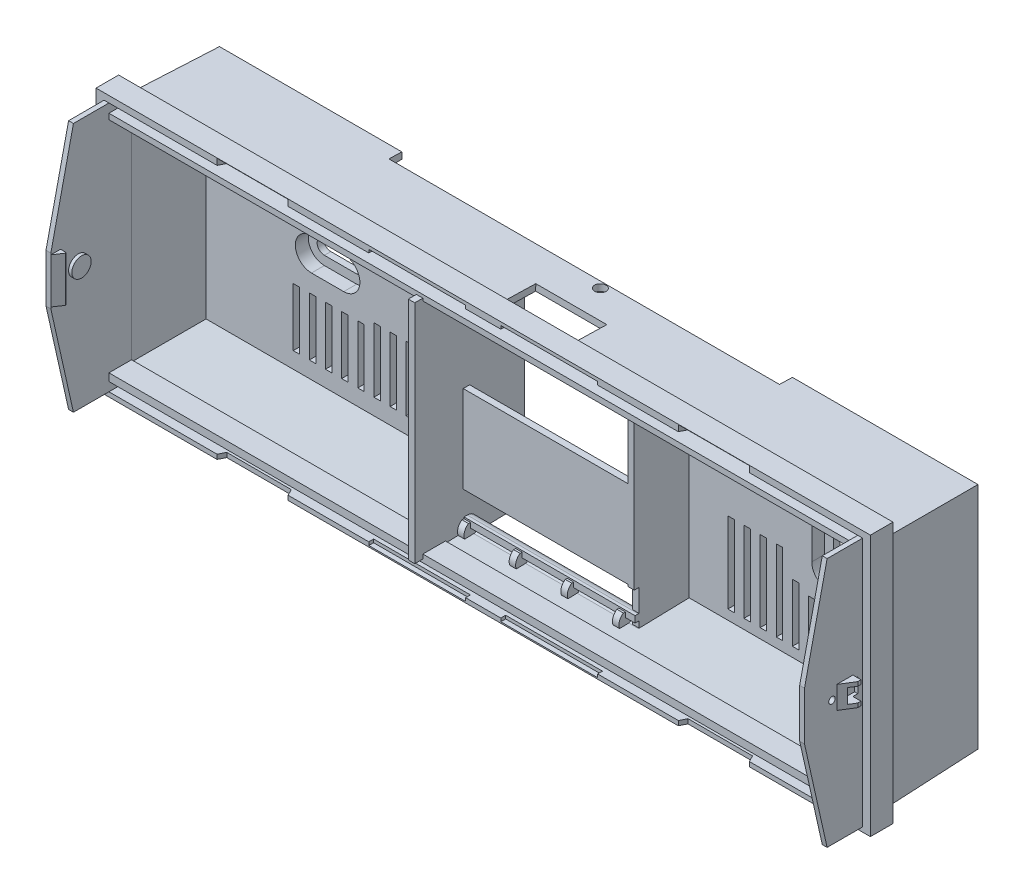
SolidWorks part; units mm, degrees
ref_plane "Plan1" through (0, 0, 0) normal (0, 0, 1) x (1, 0, 0)
ref_plane "Plan2" through (0, 0, 0) normal (0, 1, 0) x (1, 0, 0)
ref_plane "Plan3" through (0, 0, 0) normal (1, 0, 0) x (0, 0, -1)
sketch "Esquisse1" plane through (0, 0, 0) normal (0, 0, 1) x (1, 0, 0)
  line L1 (-124, 35.5) -> (111, 35.5)
  line L2 (-124, 35.5) -> (-124, -35.5)
  line L3 (-124, -35.5) -> (111, -35.5)
  line L4 (111, 35.5) -> (111, -35.5)
  dimension "D1" = 235
  dimension "D2" = 71
  dimension "D3" = 35.5
  dimension "D4" = 111
extrude "Extrusion1" add sketch "Esquisse1" along normal blind 1.5
sketch "Esquisse2" plane through (0, 0, 0) normal (0, 0, -1) x (-1, 0, 0)
  line L1 (-111, 35.5) -> (124, 35.5)
  line L2 (-111, 35.5) -> (-111, -35.5)
  line L3 (-111, -35.5) -> (124, -35.5)
  line L4 (124, 35.5) -> (124, -35.5)
extrude "Extrusion2" add sketch "Esquisse2" against normal blind 28.5 draft 1.5 from offset 4 contours L2 L3 L4 L1
sketch "Esquisse3" plane through (0, 0, 24.5) normal (0, 0, 1) x (1, 0, 0)
  line L0 (111.7463, 36.2463) -> (-124.7463, 36.2463) construction
  line L1 (-122.7463, 34.2463) -> (109.7463, 34.2463)
  line L2 (-122.7463, 34.2463) -> (-122.7463, -34.2463)
  line L3 (-122.7463, -34.2463) -> (109.7463, -34.2463)
  line L4 (109.7463, 34.2463) -> (109.7463, -34.2463)
  line L5 (-124.7463, 36.2463) -> (-124.7463, -36.2463) construction
  line L6 (111.7463, -36.2463) -> (-124.7463, -36.2463) construction
  line L7 (111.7463, 36.2463) -> (111.7463, -36.2463) construction
  dimension "D1" = 2
  dimension "D2" = 2
  dimension "D3" = 2
  dimension "D4" = 2
extrude "Enlèv. mat.-Extru.1" cut sketch "Esquisse3" against normal blind 22.5 draft 1.5
sketch "Esquisse4" plane through (0, 0, -4) normal (0, 0, -1) x (-1, 0, 0)
  line L0 (-111, 35.5) -> (124, 35.5) construction
  line L1 (-109, 33.5) -> (122, 33.5)
  line L2 (-109, 33.5) -> (-109, -33.5)
  line L3 (-109, -33.5) -> (122, -33.5)
  line L4 (122, 33.5) -> (122, -33.5)
  line L5 (-111, 35.5) -> (-111, -35.5) construction
  line L6 (-111, -35.5) -> (124, -35.5) construction
  line L7 (124, 35.5) -> (124, -35.5) construction
  dimension "D1" = 2
  dimension "D2" = 2
  dimension "D3" = 2
  dimension "D4" = 2
extrude "Enlèv. mat.-Extru.2" cut sketch "Esquisse4" against normal blind 4
sketch "Esquisse5" plane through (0, 0, 0) normal (0, 1, 0) x (1, 0, 0)
  line L1 (111, 4) -> (-124, 4) construction
  line L2 (-67.5, 4) -> (53.5, 4)
  line L3 (-67.5, 4) -> (-67.5, 0)
  line L4 (-67.5, 0) -> (53.5, 0)
  line L5 (53.5, 4) -> (53.5, 0)
  dimension "D1" = 4
  dimension "D2" = 121
  dimension "D3" = 67.5
extrude "Enlèv. mat.-Extru.3" cut sketch "Esquisse5" against normal mid plane 80
sketch "Esquisse6" plane through (0, 0, 0) normal (0, 0, -1) x (-1, 0, 0)
  line L0 (-111.7463, -36.2463) -> (124.7463, -36.2463) construction
  line L1 (-25.5, 33.6047) -> (25.5, 33.6047)
  line L2 (-25.5, 33.6047) -> (-25.5, -36.2463)
  line L3 (-25.5, -36.2463) -> (25.5, -36.2463)
  line L4 (25.5, 33.6047) -> (25.5, -36.2463)
  line L5 (-53.5, 35.6047) -> (67.5, 35.6047) construction
  dimension "D1" = 51
  dimension "D2" = 25.5
  dimension "D3" = 2
extrude "Enlèv. mat.-Extru.4" cut sketch "Esquisse6" against normal blind 17
sketch "Esquisse7" plane through (0, 35.5803, -0.9317) normal (0, 0.9997, -0.0262) x (-1, 0, 0)
  line L0 (-53.5, 0.932) -> (67.5, 0.932) construction
  line L2 (-11, 11.932) -> (11, 11.932)
  line L3 (-11, 11.932) -> (-11, 22.432)
  line L4 (-11, 22.432) -> (11, 22.432)
  line L5 (11, 11.932) -> (11, 22.432)
  circle A0 centre (0, 2.932) radius 1.75
  dimension "D1" = 3.5
  dimension "D2" = 2
  dimension "D3" = 10.5
  dimension "D4" = 22
  dimension "D5" = 11
  dimension "D6" = 11
extrude "Enlèv. mat.-Extru.5" cut sketch "Esquisse7" against normal blind 10
sketch "Esquisse8" plane through (0, 0, 0) normal (0, 0, -1) x (-1, 0, 0)
  line L0 (-25.5, 33.6047) -> (-25.5, -35.6047) construction
  line L1 (-111, 35.5) -> (-53.5, 35.5) construction
  line L2 (-78.5, 5) -> (-78.5, -5)
  line L3 (67.5, 35.5) -> (124, 35.5) construction
  line L4 (-62.5, 5) -> (-62.5, -5)
  line L5 (79.5, 8) -> (89.5, 8)
  line L6 (25.5, -35.6047) -> (25.5, 33.6047) construction
  line L7 (79.5, -8) -> (89.5, -8)
  arc A0 (-78.5, 5) -> (-62.5, 5) centre (-70.5, 5) cw
  arc A1 (-62.5, -5) -> (-78.5, -5) centre (-70.5, -5) cw
  arc A2 (79.5, 8) -> (79.5, -8) centre (79.5, 0) ccw
  arc A3 (89.5, 8) -> (89.5, -8) centre (89.5, 0) cw
  dimension "D7" = 8
  dimension "D8" = 8
  dimension "D1" = 16
  dimension "D2" = 10
  dimension "D3" = 10
  dimension "D4" = 10
  dimension "D5" = 53
  dimension "D6" = 30.5
  dimension "D9" = 10
  dimension "D10" = 10
  dimension "D11" = 10
  dimension "D12" = 16
  dimension "D13" = 35.5
  dimension "D14" = 64
extrude "Extrusion3" add sketch "Esquisse8" along normal blind 4
sketch "Esquisse9" plane through (81.6987, 0.3521, -4) normal (0, 0, -1) x (-1, 0, 0)
  line L2 (161.1987, 4.6479) -> (171.1987, 4.6479)
  line L4 (161.1987, -5.3521) -> (171.1987, -5.3521)
  line L8 (6.1987, 4.6479) -> (6.1987, -5.3521)
  line L9 (16.1987, 4.6479) -> (16.1987, -5.3521)
  arc A0 (19.1987, 4.6479) -> (3.1987, 4.6479) centre (11.1987, 4.6479) ccw construction
  arc A1 (3.1987, -5.3521) -> (19.1987, -5.3521) centre (11.1987, -5.3521) ccw construction
  arc A2 (171.1987, -8.3521) -> (171.1987, 7.6479) centre (171.1987, -0.3521) ccw construction
  arc A3 (161.1987, 7.6479) -> (161.1987, -8.3521) centre (161.1987, -0.3521) ccw construction
  arc A6 (16.1987, -5.3521) -> (6.1987, -5.3521) centre (11.1987, -5.3521) cw
  arc A7 (6.1987, 4.6479) -> (16.1987, 4.6479) centre (11.1987, 4.6479) cw
  arc A8 (171.1987, 4.6479) -> (171.1987, -5.3521) centre (171.1987, -0.3521) cw
  arc A9 (161.1987, 4.6479) -> (161.1987, -5.3521) centre (161.1987, -0.3521) ccw
  dimension "D7" = 10
  dimension "D8" = 5
  dimension "D2" = 5
  dimension "D5" = 5
  dimension "D1" = 5
  dimension "D3" = 10
  dimension "D4" = 10
  dimension "D6" = 10
  dimension "D9" = 10
  dimension "D10" = 10
extrude "Enlèv. mat.-Extru.6" cut sketch "Esquisse9" against normal blind 10 from offset 2
sketch "Esquisse10" plane through (0, 0, -4) normal (0, 0, -1) x (-1, 0, 0)
  line L2 (-72.75, 5) -> (-72.75, -5)
  line L3 (79.5, 2.25) -> (89.5, 2.25)
  line L4 (-68.25, 5) -> (-68.25, -5)
  line L6 (79.5, -2.25) -> (89.5, -2.25)
  arc A0 (-72.75, 5) -> (-68.25, 5) centre (-70.5, 5) cw
  arc A1 (-68.25, -5) -> (-72.75, -5) centre (-70.5, -5) cw
  arc A2 (-62.5, 5) -> (-78.5, 5) centre (-70.5, 5) ccw construction
  arc A3 (-78.5, -5) -> (-62.5, -5) centre (-70.5, -5) ccw construction
  arc A4 (79.5, 2.25) -> (79.5, -2.25) centre (79.5, 0) ccw
  arc A5 (89.5, 2.25) -> (89.5, -2.25) centre (89.5, 0) cw
  arc A6 (89.5, -8) -> (89.5, 8) centre (89.5, 0) ccw construction
  arc A7 (79.5, 8) -> (79.5, -8) centre (79.5, 0) ccw construction
  dimension "D2" = 2.25
  dimension "D3" = 4.5
  dimension "D5" = 10
  dimension "D1" = 4.5
  dimension "D4" = 10
  dimension "D6" = 10
extrude "Enlèv. mat.-Extru.7" cut sketch "Esquisse10" against normal blind 10
sketch "Esquisse11" plane through (0, 0, 2) normal (0, 0, 1) x (1, 0, 0)
  line L1 (25.5, 35) -> (27.5, 35)
  line L2 (25.5, 35) -> (25.5, -35)
  line L3 (25.5, -35) -> (27.5, -35)
  line L4 (27.5, 35) -> (27.5, -35)
  dimension "D1" = 2
  dimension "D2" = 70
  dimension "D3" = 35
  dimension "D4" = 25.5
extrude "Extrusion4" add sketch "Esquisse11" along normal blind 17
sketch "Esquisse12" plane through (0, 0, 2) normal (0, 0, 1) x (1, 0, 0)
  line L1 (-25.5, 35) -> (-27.5, 35)
  line L2 (-25.5, 35) -> (-25.5, -35)
  line L3 (-25.5, -35) -> (-27.5, -35)
  line L4 (-27.5, 35) -> (-27.5, -35)
  dimension "D1" = 2
  dimension "D2" = 70
  dimension "D3" = 35
  dimension "D4" = 25.5
extrude "Extrusion5" add sketch "Esquisse12" along normal blind 32
sketch "Esquisse13" plane through (25.5, 0, 0) normal (-1, 0, 0) x (0, 0, 1)
  line L1 (19, 4.5) -> (17, 4.5)
  line L2 (19, 4.5) -> (19, -22.5)
  line L3 (19, -22.5) -> (17, -22.5)
  line L4 (17, 4.5) -> (17, -22.5)
  line L6 (0, 0) -> (23.4559, 0) construction
  line L7 (19, 34.1023) -> (19, -34.1023) construction
  dimension "D1" = 2
  dimension "D2" = 27
  dimension "D3" = 4.5
extrude "Extrusion6" add sketch "Esquisse13" along normal up to next
sketch "Esquisse15" plane through (27.5, 0, 0) normal (1, 0, 0) x (0, 0, -1)
  line L0 (-19, -34.1023) -> (-19, 34.1023) construction
  line L1 (-17.5, -34.063) -> (-19, -34.1023)
  line L2 (-19, -34.1023) -> (-19, -23.1023)
  line L3 (-19, -23.1023) -> (-17.5, -23.1023)
  line L4 (-17.5, -34.063) -> (-17.5, -23.1023)
  line L7 (-19, -34.1023) -> (-2, -33.6571) construction
  point P11 (-13.9712, -36.3603)
  dimension "D1" = 11
  dimension "D2" = 1.5
extrude "Enlèv. mat.-Extru.8" cut sketch "Esquisse15" against normal blind 10
sketch "Esquisse14" plane through (-25.5, 0, 0) normal (1, 0, 0) x (0, 0, -1)
  line L0 (-24.5, -36.2463) -> (4, -35.5) construction
  line L1 (0, -35.6047) -> (0, 33.6047) construction
  line L2 (-17.75, -34.0695) -> (-17.75, -36.0695)
  line L3 (-17.75, -32.0695) -> (-18.75, -32.0695)
  line L4 (-18.75, -32.0695) -> (-18.75, -30.0695)
  line L5 (-18.75, -30.0695) -> (-17.75, -30.0695)
  arc A0 (-17.75, -36.0695) -> (-17.75, -30.0695) centre (-17.75, -33.0695) ccw
  arc A1 (-17.75, -34.0695) -> (-17.75, -32.0695) centre (-17.75, -33.0695) ccw
  dimension "D1" = 3
  dimension "D2" = 17.75
  dimension "D4" = 1
  dimension "D3" = 2
extrude "Extrusion7" add sketch "Esquisse14" along normal up to surface (53 mm away)
sketch "Esquisse16" plane through (-25.5, 0, 0) normal (1, 0, 0) x (0, 0, -1)
  line L0 (-20.3644, -34.5409) -> (-16.3644, -34.5409)
  line L1 (-16.3644, -34.5409) -> (-16.3644, -30.5409)
  line L2 (-16.3644, -30.5409) -> (-19.3644, -30.5409)
  arc A0 (-17.6977, -34.0682) -> (-17.75, -32.0695) centre (-17.75, -33.0695) ccw construction
  arc A2 (-19.3644, -30.5409) -> (-20.3644, -34.5409) centre (-17.75, -33.0695) ccw
  point P1 (-18.6119, -29.1773)
  point P7 (-19.9491, -35.2924)
  dimension "D1" = 3
  dimension "D2" = 4
  dimension "D3" = 4
  dimension "D4" = 1
extrude "Extrusion8" add sketch "Esquisse16" along normal blind 2
pattern_linear "Répétition linéaire1" count 4 spacing 16 along (1, 0, 0) of "Extrusion8"
sketch "Esquisse17" plane through (0, 0, 24.5) normal (0, 0, 1) x (1, 0, 0)
  line L1 (-122.7463, 34.2463) -> (109.1571, 34.2463)
  line L2 (-122.7463, 34.2463) -> (-122.7463, -33.6571)
  line L3 (-122.7463, -33.6571) -> (109.1571, -33.6571)
  line L4 (109.1571, 34.2463) -> (109.1571, -33.6571)
  line L5 (-126.7463, 40.7463) -> (113.1571, 40.7463)
  line L6 (-126.7463, 40.7463) -> (-126.7463, -40.1571)
  line L7 (-126.7463, -40.1571) -> (113.1571, -40.1571)
  line L8 (113.1571, 40.7463) -> (113.1571, -40.1571)
  dimension "D1" = 6.5
  dimension "D2" = 6.5
  dimension "D3" = 4
  dimension "D4" = 4
extrude "Extrusion9" add sketch "Esquisse17" along normal blind 7
sketch "Esquisse18" plane through (0, 0, 31.5) normal (0, 0, 1) x (1, 0, 0)
  line L0 (-122.7463, 34.2463) -> (-122.7463, -33.6571) construction
  line L1 (-122.7463, 35.9963) -> (109.1571, 35.9963)
  line L2 (-122.7463, 35.9963) -> (-122.7463, 38.7463)
  line L3 (-122.7463, 38.7463) -> (109.1571, 38.7463)
  line L4 (109.1571, 35.9963) -> (109.1571, 38.7463)
  line L5 (109.1571, -33.6571) -> (109.1571, 34.2463) construction
  line L6 (113.1571, 40.7463) -> (-126.7463, 40.7463) construction
  line L7 (0, 0) -> (-126.1043, 0) construction
  line L8 (109.1571, -35.9963) -> (109.1571, -38.7463)
  line L9 (-122.7463, -38.7463) -> (109.1571, -38.7463)
  line L10 (-122.7463, -35.9963) -> (-122.7463, -38.7463)
  line L11 (-122.7463, -35.9963) -> (109.1571, -35.9963)
  dimension "D1" = 2.75
  dimension "D2" = 2
extrude "Enlèv. mat.-Extru.9" cut sketch "Esquisse18" against normal blind 5
sketch "Esquisse19" plane through (0, -40.1571, 0) normal (0, -1, 0) x (1, 0, 0)
  line L0 (-126.7463, 31.5) -> (113.1571, 31.5) construction
  line L1 (-67.2463, 31.5) -> (-89.2463, 31.5)
  line L2 (-68.2463, 29.5) -> (-67.2463, 31.5)
  line L3 (-68.2463, 29.5) -> (-88.2463, 29.5)
  line L4 (-88.2463, 29.5) -> (-89.2463, 31.5)
  line L5 (113.1571, 31.5) -> (113.1571, 24.5) construction
  line L6 (74.6571, 29.5) -> (75.6571, 31.5)
  line L7 (54.6571, 29.5) -> (74.6571, 29.5)
  line L8 (54.6571, 29.5) -> (53.6571, 31.5)
  line L9 (53.6571, 31.5) -> (75.6571, 31.5)
  line L10 (-126.7463, 31.5) -> (-126.7463, 24.5) construction
  point P6 (113.1571, 28)
  point P13 (-126.7463, 28)
  dimension "D1" = 2
  dimension "D2" = 20
  dimension "D3" = 22
  dimension "D4" = 1
  dimension "D5" = 38.5
  dimension "D6" = 22
  dimension "D7" = 20
  dimension "D9" = 1
  dimension "D10" = 2
  dimension "D11" = 38.5
extrude "Enlèv. mat.-Extru.10" cut sketch "Esquisse19" against normal blind 2.5 and the other way blind 0.5
sketch "Esquisse20" plane through (0, 0, 31.5) normal (0, 0, 1) x (1, 0, 0)
  line L0 (-67.2463, -38.7463) -> (53.6571, -38.7463) construction
  line L1 (-42.2463, -38.7463) -> (-12.2463, -38.7463)
  line L2 (-42.2463, -38.7463) -> (-42.2463, -39.7463)
  line L3 (-42.2463, -39.7463) -> (-12.2463, -39.7463)
  line L4 (-12.2463, -38.7463) -> (-12.2463, -39.7463)
  line L5 (-67.2463, -38.7463) -> (-67.2463, -40.1571) construction
  line L6 (28.6571, -38.7463) -> (-1.3429, -38.7463)
  line L7 (28.6571, -38.7463) -> (28.6571, -39.7463)
  line L8 (28.6571, -39.7463) -> (-1.3429, -39.7463)
  line L9 (-1.3429, -38.7463) -> (-1.3429, -39.7463)
  point P10 (-67.2463, -39.4517)
  dimension "D1" = 1
  dimension "D2" = 30
  dimension "D3" = 25
  dimension "D4" = 1
  dimension "D5" = 30
  dimension "D6" = 25
extrude "Enlèv. mat.-Extru.11" cut sketch "Esquisse20" against normal blind 1.5
mirror "Symétrie1" about plane through (0, 0, 0) normal (0, 1, 0) of "Enlèv. mat.-Extru.10", "Enlèv. mat.-Extru.11"
sketch "Esquisse22" plane through (-122.7463, 0, 0) normal (1, 0, 0) x (0, 0, -1)
  line L0 (-31.5, -38.7463) -> (-42.5, -38.7463)
  line L1 (-42.5, -38.7463) -> (-49.5, -7.5013)
  line L2 (-49.5, -7.5013) -> (-49.5, 7.4987)
  line L3 (-49.5, 7.4987) -> (-42.5, 38.7463)
  line L4 (-42.5, 38.7463) -> (-31.5, 38.7463)
  line L6 (-31.5, 38.7463) -> (-31.5, -38.7463)
  line L10 (-26.5, -38.7463) -> (-31.5, -38.7463) construction
  line L11 (-26.5, 38.7463) -> (-31.5, 38.7463) construction
  dimension "D1" = 11
  dimension "D2" = 11
  dimension "D3" = 7
  dimension "D4" = 15
  dimension "D5" = 31.245
extrude "Extrusion11" add sketch "Esquisse22" against normal blind 1.5
sketch "Esquisse23" plane through (0, 0, 0) normal (0, 1, 0) x (1, 0, 0)
  line L0 (-122.7463, -49.5) -> (-120.7463, -46.5)
  line L1 (-120.7463, -46.5) -> (-122.7463, -46.5)
  line L2 (-122.7463, -42.5) -> (-122.7463, -49.5) construction
  line L3 (-122.7463, -46.5) -> (-122.7463, -49.5)
  dimension "D1" = 2
  dimension "D2" = 3
extrude "Extrusion12" add sketch "Esquisse23" along normal mid plane 14
sketch "Esquisse24" plane through (0, 0, 0) normal (0, 1, 0) x (1, 0, 0)
  line L0 (-124.2463, -39.5) -> (-126.7463, -35.5)
  line L1 (-124.2463, -42.5) -> (-124.2463, -31.5) construction
  line L2 (-126.7463, -35.5) -> (-126.7463, -34.5)
  line L3 (-126.7463, -34.5) -> (-124.2463, -34.5)
  line L4 (-124.2463, -34.5) -> (-124.2463, -39.5)
  line L5 (-126.7463, -31.5) -> (-89.2463, -31.5) construction
  dimension "D1" = 2.5
  dimension "D2" = 1
  dimension "D3" = 4
  dimension "D4" = 3
extrude "Extrusion13" add sketch "Esquisse24" along normal mid plane 7
fillet "Congé1" radius 0.2 1 edges at (-120.7463, 0, 46.5)
sketch "Esquisse25" plane through (0, 0, 0) normal (0, 1, 0) x (1, 0, 0)
  line L0 (-125.4963, -37.5) -> (-123.2463, -36.0938)
  line L1 (-126.7463, -35.5) -> (-124.2463, -39.5) construction
  line L2 (-123.2463, -36.0938) -> (-123.2463, -33)
  line L3 (-123.2463, -33) -> (-127.2463, -33)
  line L4 (-127.2463, -33) -> (-127.2463, -37.5)
  line L5 (-127.2463, -37.5) -> (-125.4963, -37.5)
  line L6 (-124.2463, -34.5) -> (-126.7463, -34.5) construction
  line L7 (-124.2463, -31.5) -> (-124.2463, -42.5) construction
  line L8 (-126.7463, -35.5) -> (-124.2463, -39.5) construction
  dimension "D1" = 1.5
  dimension "D2" = 1
  dimension "D3" = 90
  dimension "D4" = 4
extrude "Enlèv. mat.-Extru.12" cut sketch "Esquisse25" against normal mid plane 4.5
sketch "Esquisse26" plane through (-124.2463, 0, 0) normal (-1, 0, 0) x (0, 0, 1)
  line L0 (50, 0) -> (-50, 0) construction
  line L1 (49.5, 7.4987) -> (49.5, -7.5013) construction
  circle A0 centre (41, 0) radius 1
  point P6 (49.5, -0.0013)
  dimension "D1" = 2
  dimension "D2" = 8.5
extrude "Enlèv. mat.-Extru.13" cut sketch "Esquisse26" against normal blind 2
sketch "Esquisse27" plane through (-122.7463, 0, 0) normal (1, 0, 0) x (0, 0, -1)
  circle A0 centre (-41, 0) radius 3
  dimension "D1" = 6
extrude "Extrusion14" add sketch "Esquisse27" along normal blind 1
ref_plane "Plan4" through (-6.7463, 0, 0) normal (-1, 0, 0) x (0, 0, 1)
mirror "Symétrie3" about plane through (-6.7463, 0, 0) normal (-1, 0, 0) of "Extrusion14", "Enlèv. mat.-Extru.13", "Enlèv. mat.-Extru.12", "Congé1", "Extrusion13", "Extrusion12", "Extrusion11"
sketch "Esquisse28" plane through (0, 0, 2) normal (0, 0, 1) x (1, 0, 0)
  line L0 (-122.1571, 33.6571) -> (-122.1571, -33.6571) construction
  line L1 (-95.1571, 28.6571) -> (-93.1571, 28.6571)
  line L2 (-95.1571, 28.6571) -> (-95.1571, 8.6571)
  line L3 (-95.1571, 8.6571) -> (-93.1571, 8.6571)
  line L4 (-93.1571, 28.6571) -> (-93.1571, 8.6571)
  line L5 (-27.5, 33.6571) -> (-122.1571, 33.6571) construction
  line L6 (-90.1571, 28.6571) -> (-88.1571, 28.6571)
  line L7 (-90.1571, 28.6571) -> (-90.1571, 8.6571)
  line L8 (-90.1571, 8.6571) -> (-88.1571, 8.6571)
  line L9 (-88.1571, 28.6571) -> (-88.1571, 8.6571)
  line L10 (-85.1571, 28.6571) -> (-83.1571, 28.6571)
  line L11 (-85.1571, 28.6571) -> (-85.1571, 8.6571)
  line L12 (-85.1571, 8.6571) -> (-83.1571, 8.6571)
  line L13 (-83.1571, 28.6571) -> (-83.1571, 8.6571)
  line L14 (-80.1571, 28.6571) -> (-78.1571, 28.6571)
  line L15 (-80.1571, 28.6571) -> (-80.1571, 8.6571)
  line L16 (-80.1571, 8.6571) -> (-78.1571, 8.6571)
  line L17 (-78.1571, 28.6571) -> (-78.1571, 8.6571)
  line L18 (-75.1571, 28.6571) -> (-73.1571, 28.6571)
  line L19 (-75.1571, 28.6571) -> (-75.1571, 8.6571)
  line L20 (-75.1571, 8.6571) -> (-73.1571, 8.6571)
  line L21 (-73.1571, 28.6571) -> (-73.1571, 8.6571)
  line L22 (-70.1571, 28.6571) -> (-68.1571, 28.6571)
  line L23 (-70.1571, 28.6571) -> (-70.1571, 8.6571)
  line L24 (-70.1571, 8.6571) -> (-68.1571, 8.6571)
  line L25 (-68.1571, 28.6571) -> (-68.1571, 8.6571)
  line L26 (-65.1571, 28.6571) -> (-63.1571, 28.6571)
  line L27 (-65.1571, 28.6571) -> (-65.1571, 8.6571)
  line L28 (-65.1571, 8.6571) -> (-63.1571, 8.6571)
  line L29 (-63.1571, 28.6571) -> (-63.1571, 8.6571)
  line L30 (-60.1571, 28.6571) -> (-58.1571, 28.6571)
  line L31 (-60.1571, 28.6571) -> (-60.1571, 8.6571)
  line L32 (-60.1571, 8.6571) -> (-58.1571, 8.6571)
  line L33 (-58.1571, 28.6571) -> (-58.1571, 8.6571)
  line L34 (-55.1571, 28.6571) -> (-53.1571, 28.6571)
  line L35 (-55.1571, 28.6571) -> (-55.1571, 8.6571)
  line L36 (-55.1571, 8.6571) -> (-53.1571, 8.6571)
  line L37 (-53.1571, 28.6571) -> (-53.1571, 8.6571)
  line L38 (-89.5, 0) -> (-79.5, 0) construction
  line L39 (-53.1571, -28.6571) -> (-53.1571, -8.6571)
  line L40 (-55.1571, -8.6571) -> (-53.1571, -8.6571)
  line L41 (-55.1571, -28.6571) -> (-55.1571, -8.6571)
  line L42 (-55.1571, -28.6571) -> (-53.1571, -28.6571)
  line L43 (-58.1571, -28.6571) -> (-58.1571, -8.6571)
  line L44 (-60.1571, -8.6571) -> (-58.1571, -8.6571)
  line L45 (-60.1571, -28.6571) -> (-60.1571, -8.6571)
  line L46 (-60.1571, -28.6571) -> (-58.1571, -28.6571)
  line L47 (-63.1571, -28.6571) -> (-63.1571, -8.6571)
  line L48 (-65.1571, -8.6571) -> (-63.1571, -8.6571)
  line L49 (-65.1571, -28.6571) -> (-65.1571, -8.6571)
  line L50 (-65.1571, -28.6571) -> (-63.1571, -28.6571)
  line L51 (-68.1571, -28.6571) -> (-68.1571, -8.6571)
  line L52 (-70.1571, -8.6571) -> (-68.1571, -8.6571)
  line L53 (-70.1571, -28.6571) -> (-70.1571, -8.6571)
  line L54 (-70.1571, -28.6571) -> (-68.1571, -28.6571)
  line L55 (-90.1571, -10.6571) -> (-88.1571, -10.6571)
  line L56 (-95.1571, -10.6571) -> (-93.1571, -10.6571)
  line L57 (-95.1571, -10.6571) -> (-95.1571, -28.6571)
  line L58 (-95.1571, -28.6571) -> (-93.1571, -28.6571)
  line L59 (-93.1571, -10.6571) -> (-93.1571, -28.6571)
  line L60 (-90.1571, -10.6571) -> (-90.1571, -28.6571)
  line L61 (-90.1571, -28.6571) -> (-88.1571, -28.6571)
  line L62 (-88.1571, -10.6571) -> (-88.1571, -28.6571)
  line L63 (-85.1571, -10.6571) -> (-83.1571, -10.6571)
  line L64 (-85.1571, -10.6571) -> (-85.1571, -28.6571)
  line L65 (-85.1571, -28.6571) -> (-83.1571, -28.6571)
  line L66 (-83.1571, -10.6571) -> (-83.1571, -28.6571)
  line L67 (-80.1571, -10.6571) -> (-78.1571, -10.6571)
  line L68 (-80.1571, -10.6571) -> (-80.1571, -28.6571)
  line L69 (-80.1571, -28.6571) -> (-78.1571, -28.6571)
  line L70 (-78.1571, -10.6571) -> (-78.1571, -28.6571)
  line L71 (-75.1571, -10.6571) -> (-73.1571, -10.6571)
  line L72 (-75.1571, -10.6571) -> (-75.1571, -28.6571)
  line L73 (-75.1571, -28.6571) -> (-73.1571, -28.6571)
  line L74 (-73.1571, -10.6571) -> (-73.1571, -28.6571)
  line L75 (-122.7463, -33.6571) -> (-27.5, -33.6571) construction
  line L76 (-25.5, -33.6571) -> (109.1571, -33.6571) construction
  line L77 (39.5, -30.6571) -> (41.5, -30.6571)
  line L78 (39.5, -30.6571) -> (39.5, -5.6571)
  line L79 (39.5, -5.6571) -> (41.5, -5.6571)
  line L80 (41.5, -30.6571) -> (41.5, -5.6571)
  line L81 (27.5, -23.1023) -> (27.5, 34.1023) construction
  line L82 (44.5, -30.6571) -> (46.5, -30.6571)
  line L83 (44.5, -30.6571) -> (44.5, -5.6571)
  line L84 (44.5, -5.6571) -> (46.5, -5.6571)
  line L85 (46.5, -30.6571) -> (46.5, -5.6571)
  line L86 (49.5, -30.6571) -> (51.5, -30.6571)
  line L87 (49.5, -30.6571) -> (49.5, -5.6571)
  line L88 (49.5, -5.6571) -> (51.5, -5.6571)
  line L89 (51.5, -30.6571) -> (51.5, -5.6571)
  line L90 (54.5, -30.6571) -> (56.5, -30.6571)
  line L91 (54.5, -30.6571) -> (54.5, -5.6571)
  line L92 (54.5, -5.6571) -> (56.5, -5.6571)
  line L93 (56.5, -30.6571) -> (56.5, -5.6571)
  line L94 (-25.5, -33.6571) -> (109.1571, -33.6571) construction
  line L95 (109.1571, 33.6571) -> (27.5, 33.6571) construction
  line L96 (59.5, -30.6571) -> (61.5, -30.6571)
  line L97 (59.5, -30.6571) -> (59.5, -12.6571)
  line L98 (59.5, -12.6571) -> (61.5, -12.6571)
  line L99 (61.5, -30.6571) -> (61.5, -12.6571)
  line L100 (64.5, -30.6571) -> (66.5, -30.6571)
  line L101 (64.5, -30.6571) -> (64.5, -14.6571)
  line L102 (64.5, -14.6571) -> (66.5, -14.6571)
  line L103 (66.5, -30.6571) -> (66.5, -14.6571)
  line L104 (69.5, -30.6571) -> (71.5, -30.6571)
  line L105 (69.5, -30.6571) -> (69.5, -14.6571)
  line L106 (69.5, -14.6571) -> (71.5, -14.6571)
  line L107 (71.5, -30.6571) -> (71.5, -14.6571)
  line L108 (74.5, -30.6571) -> (76.5, -30.6571)
  line L109 (74.5, -30.6571) -> (74.5, -12.6571)
  line L110 (74.5, -12.6571) -> (76.5, -12.6571)
  line L111 (76.5, -30.6571) -> (76.5, -12.6571)
  line L112 (79.5, -30.6571) -> (81.5, -30.6571)
  line L113 (79.5, -30.6571) -> (79.5, -5.6571)
  line L114 (79.5, -5.6571) -> (81.5, -5.6571)
  line L115 (81.5, -30.6571) -> (81.5, -5.6571)
  line L116 (81.5, 5.6571) -> (79.5, 5.6571)
  line L117 (81.5, 5.6571) -> (81.5, 28.6571)
  line L118 (81.5, 28.6571) -> (79.5, 28.6571)
  line L119 (79.5, 5.6571) -> (79.5, 28.6571)
  line L120 (109.2537, 38.7463) -> (109.2537, 7.4987) construction
  line L121 (71.5, 28.6571) -> (69.5, 28.6571)
  line L122 (76.5, 28.6571) -> (74.5, 28.6571)
  line L123 (76.5, 28.6571) -> (76.5, 13.6571)
  line L124 (76.5, 13.6571) -> (74.5, 13.6571)
  line L125 (74.5, 28.6571) -> (74.5, 13.6571)
  line L126 (71.5, 28.6571) -> (71.5, 13.6571)
  line L127 (71.5, 13.6571) -> (69.5, 13.6571)
  line L128 (69.5, 28.6571) -> (69.5, 13.6571)
  line L129 (66.5, 28.6571) -> (64.5, 28.6571)
  line L130 (66.5, 28.6571) -> (66.5, 13.6571)
  line L131 (66.5, 13.6571) -> (64.5, 13.6571)
  line L132 (64.5, 28.6571) -> (64.5, 13.6571)
  line L133 (61.5, 28.6571) -> (59.5, 28.6571)
  line L134 (61.5, 28.6571) -> (61.5, 13.6571)
  line L135 (61.5, 13.6571) -> (59.5, 13.6571)
  line L136 (59.5, 28.6571) -> (59.5, 13.6571)
  line L137 (51.5, 28.6571) -> (49.5, 28.6571)
  line L138 (56.5, 28.6571) -> (54.5, 28.6571)
  line L139 (56.5, 28.6571) -> (56.5, 5.6571)
  line L140 (56.5, 5.6571) -> (54.5, 5.6571)
  line L141 (54.5, 28.6571) -> (54.5, 5.6571)
  line L142 (51.5, 28.6571) -> (51.5, 5.6571)
  line L143 (51.5, 5.6571) -> (49.5, 5.6571)
  line L144 (49.5, 28.6571) -> (49.5, 5.6571)
  line L145 (46.5, 28.6571) -> (44.5, 28.6571)
  line L146 (46.5, 28.6571) -> (46.5, 5.6571)
  line L147 (46.5, 5.6571) -> (44.5, 5.6571)
  line L148 (44.5, 28.6571) -> (44.5, 5.6571)
  line L149 (41.5, 28.6571) -> (39.5, 28.6571)
  line L150 (41.5, 28.6571) -> (41.5, 5.6571)
  line L151 (41.5, 5.6571) -> (39.5, 5.6571)
  line L152 (39.5, 28.6571) -> (39.5, 5.6571)
  point P86 (41.8286, -33.6571)
  dimension "D1" = 27
  dimension "D2" = 2
  dimension "D3" = 20
  dimension "D4" = 5
  dimension "D5" = 5
  dimension "D6" = 5
  dimension "D7" = 27
  dimension "D8" = 2
  dimension "D9" = 18
  dimension "D10" = 5
  dimension "D11" = 5
  dimension "D12" = 3
  dimension "D13" = 25
  dimension "D14" = 2
  dimension "D15" = 12
  dimension "D16" = 5
  dimension "D17" = 3
  dimension "D18" = 2
  dimension "D19" = 3
  dimension "D20" = 3
  dimension "D21" = 2
  dimension "D22" = 3
  dimension "D23" = 2
  dimension "D24" = 3
  dimension "D25" = 2
  dimension "D26" = 3
  dimension "D27" = 2
  dimension "D28" = 25
  dimension "D29" = 18
  dimension "D30" = 16
  dimension "D31" = 16
  dimension "D32" = 18
  dimension "D33" = 5
  dimension "D34" = 23
  dimension "D35" = 2
  dimension "D36" = 27.7537
  dimension "D37" = 3
  dimension "D38" = 2
  dimension "D39" = 15
  dimension "D40" = 5
  dimension "D41" = 5
  dimension "D42" = 2
  dimension "D43" = 23
  dimension "D44" = 5
extrude "Enlèv. mat.-Extru.14" cut sketch "Esquisse28" against normal blind 10
